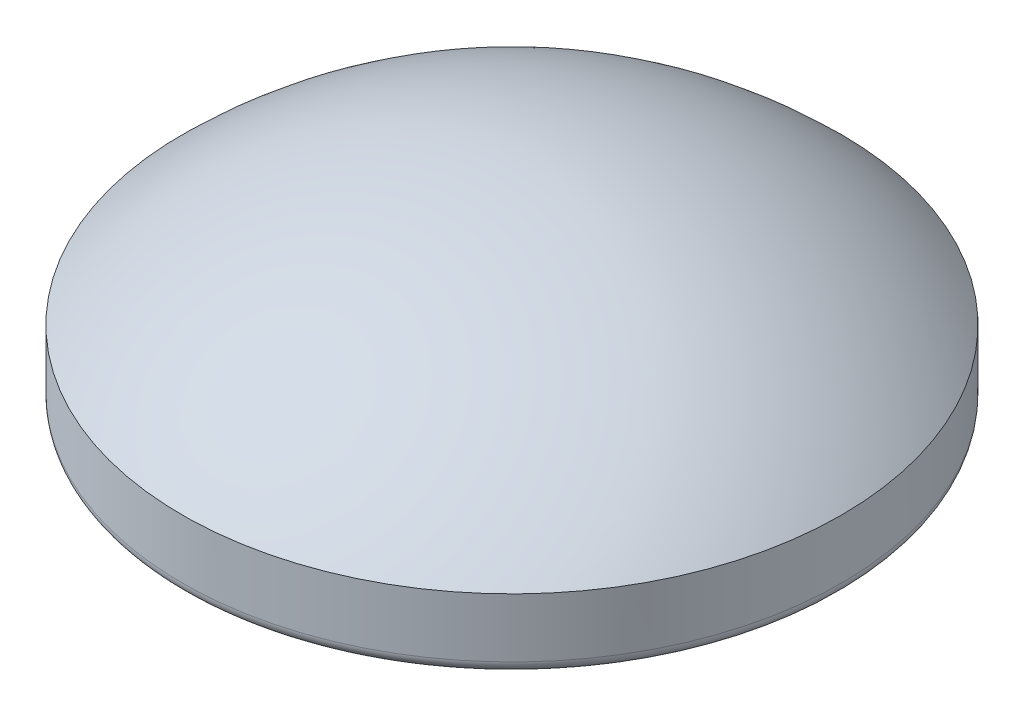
SolidWorks part; units mm, degrees
ref_plane "Plan de face" through (0, 0, 0) normal (0, 0, 1) x (1, 0, 0)
ref_plane "Plan de dessus" through (0, 0, 0) normal (0, 1, 0) x (1, 0, 0)
ref_plane "Plan de droite" through (0, 0, 0) normal (1, 0, 0) x (0, 0, -1)
sketch "Esquisse1" plane through (0, 0, 0) normal (0, 0, 1) x (1, 0, 0)
  line L0 (25.1, 0) -> (25.1, 5)
  line L1 (0, 0) -> (0, 62.88) construction
  line L2 (27.1, 1) -> (27.1, 5.8469)
  line L3 (25.1, 0) -> (26.1, 0)
  line L4 (0, 15) -> (0, 17)
  line L5 (27.1, 0) -> (27.1, 5.8469) construction
  arc A0 (25.1, 5) -> (0, 15) centre (0, -21.5005) ccw
  arc A1 (27.1, 5.8469) -> (0, 17) centre (0, -21.5005) ccw
  arc A2 (27.1, 1) -> (26.1, 0) centre (26.1, 1) cw
  dimension "D3" = 17
  dimension "D5" = 1
  dimension "D1" = 25.1
  dimension "D2" = 5
  dimension "D4" = 2
revolve "Révolution1" add sketch "Esquisse1" angle 360 about L1
